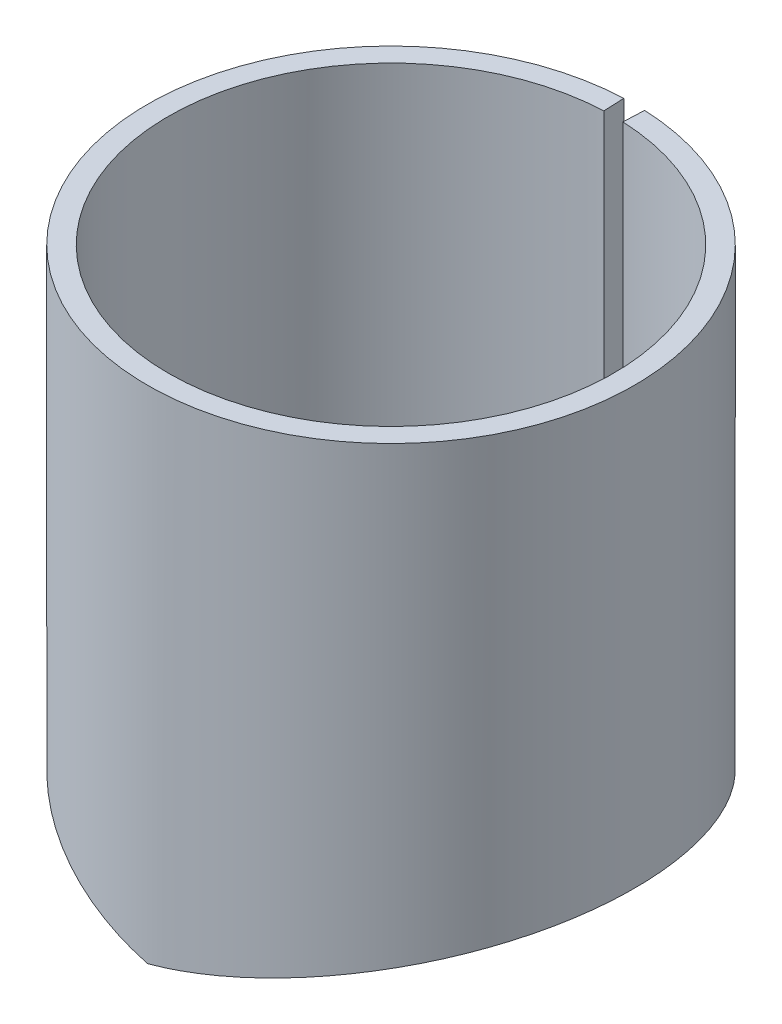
SolidWorks part; units mm, degrees
ref_plane "前视基准面" through (0, 0, 0) normal (0, 0, 1) x (1, 0, 0)
ref_plane "上视基准面" through (0, 0, 0) normal (0, 1, 0) x (1, 0, 0)
ref_plane "右视基准面" through (0, 0, 0) normal (1, 0, 0) x (0, 0, -1)
imported_body "基体零件-带补料的120°Y形三通管-1"
sheet metal parameters "钣金1" parameters "D1"=0.7366, "厚度"=1
bend "圆角折弯1" bend radius 10.6658 bend angle 355.087 parameters "D5"=1
flatten bends "展开-折弯1"
sketch "尖角-草图1" plane through (-0.5, 28.067, -11.6551) normal (-0.0429, 0, -0.9991) x (-0.9991, 0, 0.0429)
  line L0 (33.0504, 11.933) -> (33.0504, -11.933) construction
  dimension "D1" = 0
process bends "加工-折弯1" parameters "D1"=0
sketch "平面-草图1" plane through (-0.5, 28.067, -11.6551) normal (-0.0429, 0, -0.9991) x (-0.9991, 0, 0.0429)
